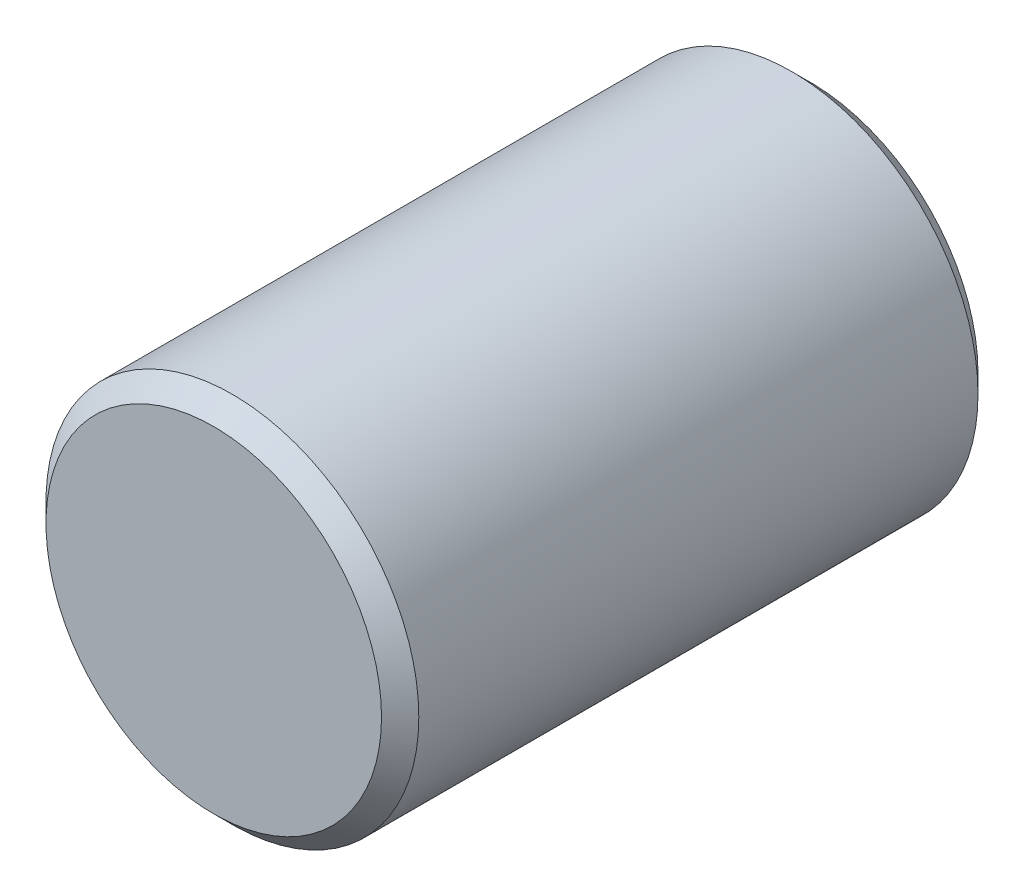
SolidWorks part; units mm, degrees
ref_plane "Front Plane" through (0, 0, 0) normal (0, 0, 1) x (1, 0, 0)
ref_plane "Top Plane" through (0, 0, 0) normal (0, 1, 0) x (1, 0, 0)
ref_plane "Right Plane" through (0, 0, 0) normal (1, 0, 0) x (0, 0, -1)
sketch "Sketch1" plane through (0, 0, 0) normal (1, 0, 0) x (0, 0, -1)
  line L0 (10.6747, 0) -> (50010.6747, 0) construction
  line L1 (0, 0) -> (8, 0)
  line L6 (0.25, 2.5) -> (0, 2.25)
  line L7 (0, 2.25) -> (0, 0)
  line L8 (7.75, 2.5) -> (0.25, 2.5)
  line L9 (8, 2.25) -> (7.75, 2.5)
  line L10 (8, 0) -> (8, 2.25)
  dimension "D1" = 45
  dimension "D2" = 45
  dimension "D3" = 8
  dimension "D4" = 0.25
  dimension "D5" = 5
revolve "Revolve1" add sketch "Sketch1" angle 360 about L0
